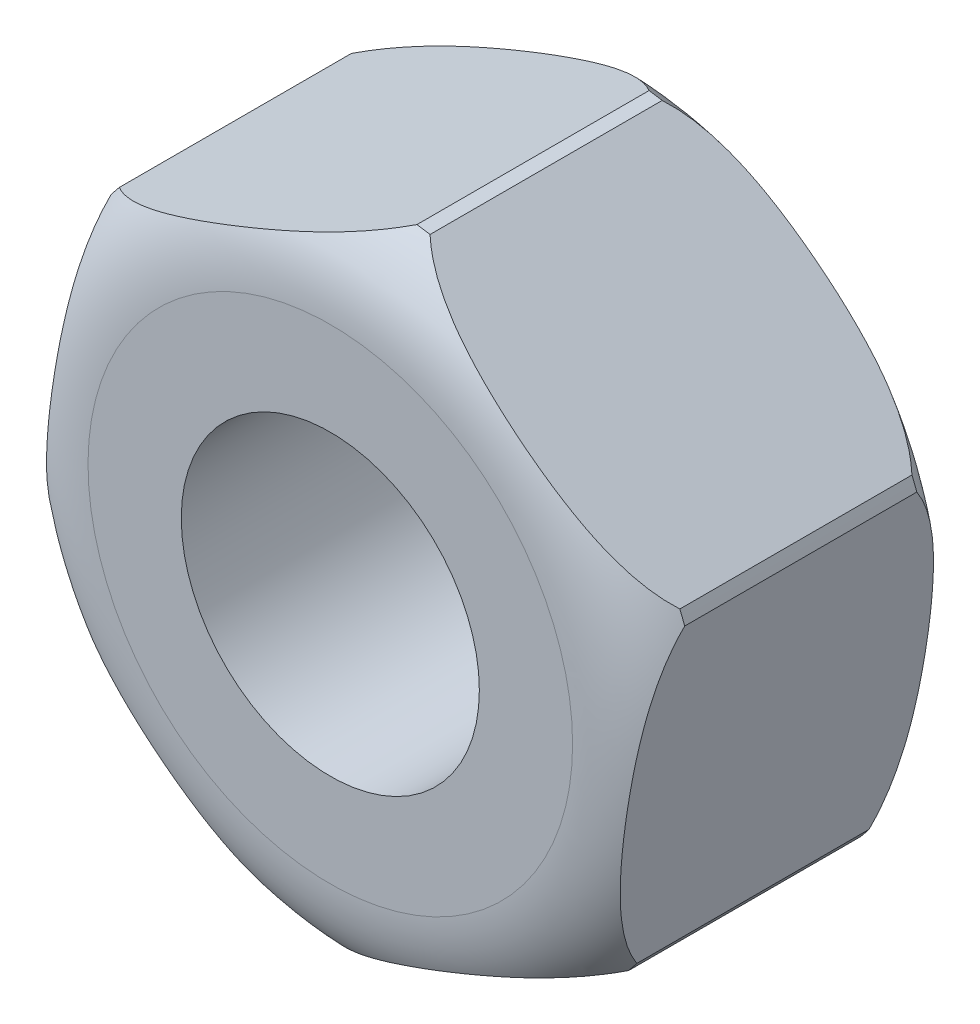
SolidWorks part; units mm, degrees
ref_plane "Plan de face" through (0, 0, 0) normal (0, 0, 1) x (1, 0, 0)
ref_plane "Plan de dessus" through (0, 0, 0) normal (0, 1, 0) x (1, 0, 0)
ref_plane "Plan de droite" through (0, 0, 0) normal (1, 0, 0) x (0, 0, -1)
sketch "Esquisse1" plane through (0, 0, 0) normal (0, 0, 1) x (1, 0, 0)
  line L1 (-2.459, 1.9632) -> (-2.9297, -1.148)
  line L2 (-2.9297, -1.148) -> (-0.4707, -3.1112)
  line L3 (-0.4707, -3.1112) -> (2.459, -1.9632)
  line L4 (2.459, -1.9632) -> (2.9297, 1.148)
  line L5 (2.9297, 1.148) -> (0.4707, 3.1112)
  line L6 (0.4707, 3.1112) -> (-2.459, 1.9632)
  circle A0 centre (0, 0) radius 2.725 construction
  dimension "D1" = 5.45
extrude "Boss.-Extru.1" add sketch "Esquisse1" along normal blind 3
sketch "Esquisse4" plane through (0, 0, 3) normal (0, 0, 1) x (1, 0, 0)
  circle A0 centre (0, 0) radius 1.4
  dimension "D1" = 2.8
extrude "Enlèv. mat.-Extru.2" cut sketch "Esquisse4" against normal through all
sketch "Esquisse5" plane through (0, 0, 0) normal (1, 0, 0) x (0, 0, -1)
  line L0 (-3, 0) -> (0, 0) construction
  line L1 (-3, 3.1112) -> (0, 3.1112) construction
  line L2 (0, 1.148) -> (0, 3.1112) construction
  line L3 (-3, -1.9632) -> (-3, 1.148) construction
  line L5 (-1.5, 0) -> (-1.5, 4.0704) construction
  line L6 (-2.5901, 3.1112) -> (-0.4099, 3.1112)
  line L7 (0, 2.2758) -> (0.9511, 2.2758)
  line L8 (0.9511, 2.2758) -> (0.9511, 4.0704)
  line L9 (0.9511, 4.0704) -> (-3.6138, 4.0704)
  line L10 (-3.6138, 4.0704) -> (-3.6138, 2.2758)
  line L11 (-3.6138, 2.2758) -> (-3, 2.2758)
  spline S0 degree 2 poles (-2.5901, 3.1112) (-2.985, 2.8427) (-3, 2.2758) knots 0 0 0 1 1 1
  spline S3 degree 2 poles (-0.4099, 3.1112) (-0.015, 2.8427) (0, 2.2758) knots 0 0 0 1 1 1
revolve "Enlèvement de matière-Révolution1" cut sketch "Esquisse5" angle 360 about L0
